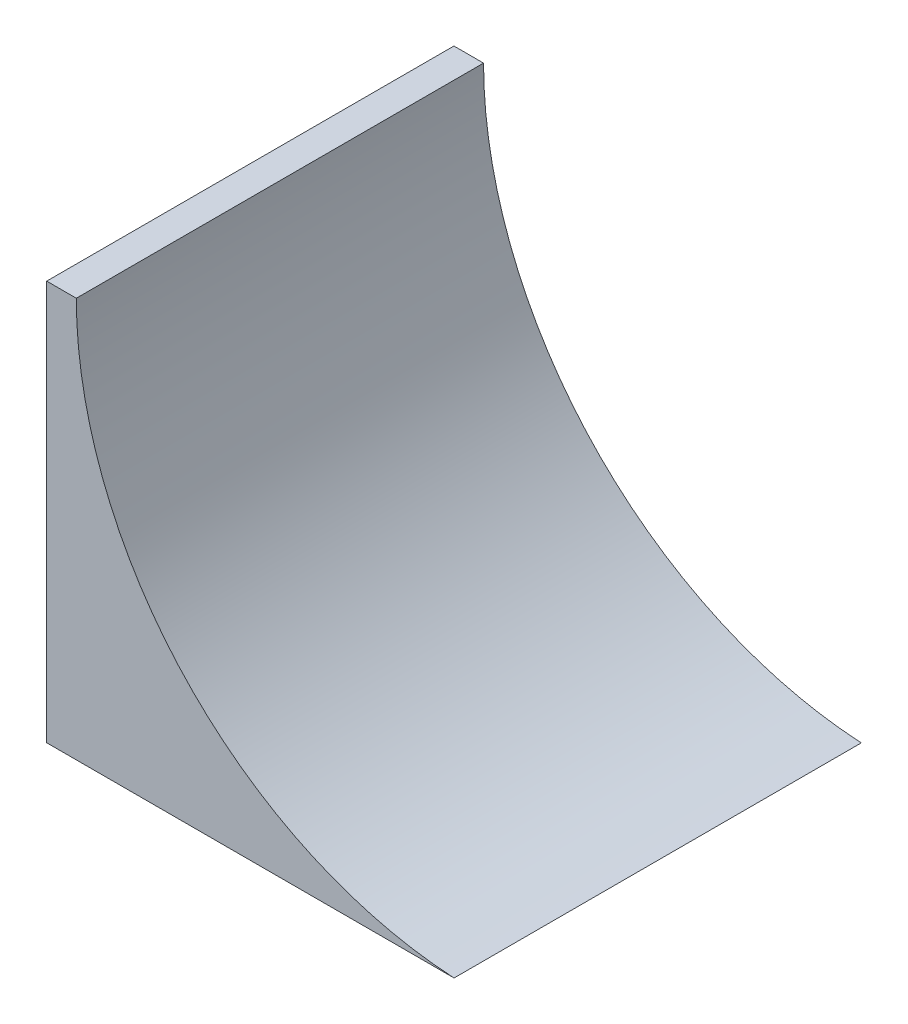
SolidWorks part; units mm, degrees
other "ExplView1" [suppressed]
ref_plane "Front Plane" through (0, 0, 0) normal (0, 0, 1) x (1, 0, 0)
ref_plane "Top Plane" through (0, 0, 0) normal (0, 1, 0) x (1, 0, 0)
ref_plane "Right Plane" through (0, 0, 0) normal (1, 0, 0) x (0, 0, -1)
sketch "Sketch1" plane through (0, 0, 0) normal (0, 0, 1) x (1, 0, 0)
  line L0 (0, 0) -> (0, 68.58)
  line L1 (0, 68.58) -> (5.08, 68.58)
  line L2 (69.8752, 0) -> (0, 0)
  line L3 (5.08, 68.58) -> (5.08, 95.7425) construction
  arc A0 (5.08, 68.58) -> (69.8752, 0) centre (73.7705, 68.58) ccw
  dimension "D1" = 5.08
  dimension "D3" = 68.58
  dimension "D5" = 69.8752
extrude "Boss-Extrude1" add sketch "Sketch1" along normal mid plane 69.85
sketch "Sketch2" plane through (0, 0, 0) normal (-1, 0, 0) x (0, 0, 1)
  line L0 (-34.925, 31.75) -> (-17.4625, 31.75) construction
  line L1 (-34.925, 68.58) -> (-34.925, 0) construction
  line L2 (-17.4625, 31.75) -> (17.4625, 31.75) construction
  line L3 (34.925, 0) -> (-34.925, 0) construction
  line L4 (17.4625, 31.75) -> (34.925, 31.75) construction
  line L5 (34.925, 68.58) -> (34.925, 0) construction
  circle A0 centre (-17.4625, 31.75) radius 4.064
  circle A1 centre (17.4625, 31.75) radius 4.064
  dimension "D3" = 8.128
  dimension "D1" = 31.75
  dimension "D2" = 34.925
extrude "Cut-Extrude1" cut sketch "Sketch2" against normal blind 3.048
